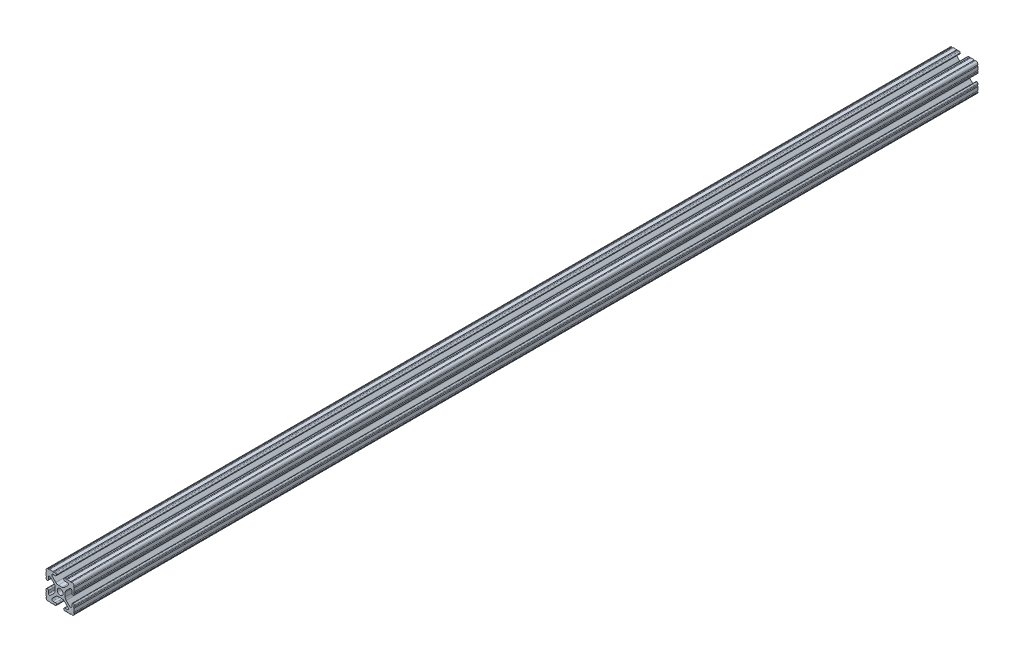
SolidWorks part; units mm, degrees
ref_plane "Front Plane" through (0, 0, 0) normal (0, 0, 1) x (1, 0, 0)
ref_plane "Top Plane" through (0, 0, 0) normal (0, 1, 0) x (1, 0, 0)
ref_plane "Right Plane" through (0, 0, 0) normal (1, 0, 0) x (0, 0, -1)
sketch "Sketch1" plane through (0, 0, 0) normal (0, 0, 1) x (1, 0, 0)
  line L0 (-7.207, 8.7244) -> (-3.8983, 5.4232)
  line L1 (-4.2875, 10.4902) -> (-6.4768, 10.4902)
  line L2 (-3.2385, 11.651) -> (-3.2385, 11.5392)
  line L3 (-5.3171, 12.7) -> (-4.2875, 12.7)
  line L4 (0, 13.4005) -> (0, -14.8534) construction
  line L5 (12.7, 0) -> (-13.9989, 0) construction
  line L6 (-9.5504, 12.7) -> (-6.3331, 12.7)
  line L7 (-12.7, 6.3331) -> (-12.7, 9.5504)
  line L8 (-12.7, 4.2875) -> (-12.7, 5.3171)
  line L9 (-11.5392, 3.2385) -> (-11.651, 3.2385)
  line L10 (-10.4902, 6.4021) -> (-10.4902, 4.2875)
  line L11 (-5.441, 3.8408) -> (-8.7371, 7.1294)
  line L12 (-4.5085, -1.5932) -> (-4.5085, 1.5932)
  line L13 (-1.7093, -4.4958) -> (1.7093, -4.4958)
  line L14 (3.9523, -5.4237) -> (7.1797, -8.6452)
  line L15 (6.4164, -10.4902) -> (4.2875, -10.4902)
  line L16 (3.2385, -11.5392) -> (3.2385, -11.651)
  line L17 (4.2875, -12.7) -> (5.3171, -12.7)
  line L18 (6.3331, -12.7) -> (9.5504, -12.7)
  line L19 (12.7, -9.5504) -> (12.7, -6.3331)
  line L20 (12.7, -5.3171) -> (12.7, -4.2875)
  line L21 (11.651, -3.2385) -> (11.5392, -3.2385)
  line L22 (10.4902, -4.2875) -> (10.4902, -6.4021)
  line L23 (8.7371, -7.1294) -> (5.441, -3.8408)
  line L24 (4.5085, -1.5932) -> (4.5085, 1.5932)
  line L25 (5.441, 3.8408) -> (8.7371, 7.1294)
  line L26 (10.4902, 6.4021) -> (10.4902, 4.2875)
  line L27 (11.5392, 3.2385) -> (11.651, 3.2385)
  line L28 (12.7, 4.2875) -> (12.7, 5.3171)
  line L29 (12.7, 6.3331) -> (12.7, 9.5504)
  line L30 (9.5504, 12.7) -> (6.3331, 12.7)
  line L31 (5.3171, 12.7) -> (4.2875, 12.7)
  line L32 (3.2385, 11.651) -> (3.2385, 11.5392)
  line L33 (4.2875, 10.4902) -> (6.4768, 10.4902)
  line L34 (7.207, 8.7244) -> (3.8983, 5.4232)
  line L35 (1.6558, 4.4958) -> (-1.6558, 4.4958)
  line L36 (-8.7371, -7.1294) -> (-5.441, -3.8408)
  line L37 (-10.4902, -4.2875) -> (-10.4902, -6.4021)
  line L38 (-11.651, -3.2385) -> (-11.5392, -3.2385)
  line L39 (-12.7, -5.3171) -> (-12.7, -4.2875)
  line L40 (-12.7, -9.5504) -> (-12.7, -6.3331)
  line L41 (-6.3331, -12.7) -> (-9.5504, -12.7)
  line L42 (-4.2875, -12.7) -> (-5.3171, -12.7)
  line L43 (-3.2385, -11.5392) -> (-3.2385, -11.651)
  line L44 (-6.4164, -10.4902) -> (-4.2875, -10.4902)
  line L45 (-3.9523, -5.4237) -> (-7.1797, -8.6452)
  arc A0 (-7.207, 8.7244) -> (-6.4768, 10.4902) centre (-6.4768, 9.4563) cw
  arc A1 (-3.2385, 11.5392) -> (-4.2875, 10.4902) centre (-4.2875, 11.5392) cw
  arc A2 (-4.2875, 12.7) -> (-3.2385, 11.651) centre (-4.2875, 11.651) cw
  arc A3 (-5.3171, 12.7) -> (-6.3331, 12.7) centre (-5.8251, 12.7) cw
  arc A4 (-9.5504, 12.7) -> (-10.5664, 12.6998) centre (-10.0584, 12.7) cw
  arc A5 (-12.6998, 10.5664) -> (-10.5664, 12.6998) centre (-10.5918, 10.5918) cw
  arc A6 (-12.6998, 10.5664) -> (-12.7, 9.5504) centre (-12.7, 10.0584) cw
  arc A7 (-12.7, 6.3331) -> (-12.7, 5.3171) centre (-12.7, 5.8251) cw
  arc A8 (-11.651, 3.2385) -> (-12.7, 4.2875) centre (-11.651, 4.2875) cw
  arc A9 (-10.4902, 4.2875) -> (-11.5392, 3.2385) centre (-11.5392, 4.2875) cw
  circle A10 centre (0, 0) radius 2.6035
  arc A11 (-10.4902, 6.4021) -> (-8.7371, 7.1294) centre (-9.4628, 6.4021) cw
  arc A12 (-5.441, 3.8408) -> (-4.5085, 1.5932) centre (-7.6835, 1.5932) cw
  arc A13 (-4.5085, -1.5932) -> (-5.441, -3.8408) centre (-7.6835, -1.5932) cw
  arc A14 (-8.7371, -7.1294) -> (-10.4902, -6.4021) centre (-9.4628, -6.4021) cw
  arc A15 (-1.7093, -4.4958) -> (-3.9523, -5.4237) centre (-1.7093, -7.6708) ccw
  arc A16 (3.9523, -5.4237) -> (1.7093, -4.4958) centre (1.7093, -7.6708) ccw
  arc A17 (6.4164, -10.4902) -> (7.1797, -8.6452) centre (6.4164, -9.4098) ccw
  arc A18 (4.2875, -10.4902) -> (3.2385, -11.5392) centre (4.2875, -11.5392) ccw
  arc A19 (3.2385, -11.651) -> (4.2875, -12.7) centre (4.2875, -11.651) ccw
  arc A20 (6.3331, -12.7) -> (5.3171, -12.7) centre (5.8251, -12.7) ccw
  arc A21 (10.5664, -12.6998) -> (9.5504, -12.7) centre (10.0584, -12.7) ccw
  arc A22 (10.5664, -12.6998) -> (12.6998, -10.5664) centre (10.5918, -10.5918) ccw
  arc A23 (12.7, -9.5504) -> (12.6998, -10.5664) centre (12.7, -10.0584) ccw
  arc A24 (12.7, -5.3171) -> (12.7, -6.3331) centre (12.7, -5.8251) ccw
  arc A25 (12.7, -4.2875) -> (11.651, -3.2385) centre (11.651, -4.2875) ccw
  arc A26 (11.5392, -3.2385) -> (10.4902, -4.2875) centre (11.5392, -4.2875) ccw
  arc A27 (8.7371, -7.1294) -> (10.4902, -6.4021) centre (9.4628, -6.4021) ccw
  arc A28 (4.5085, -1.5932) -> (5.441, -3.8408) centre (7.6835, -1.5932) ccw
  arc A29 (5.441, 3.8408) -> (4.5085, 1.5932) centre (7.6835, 1.5932) ccw
  arc A30 (10.4902, 6.4021) -> (8.7371, 7.1294) centre (9.4628, 6.4021) ccw
  arc A31 (10.4902, 4.2875) -> (11.5392, 3.2385) centre (11.5392, 4.2875) ccw
  arc A32 (11.651, 3.2385) -> (12.7, 4.2875) centre (11.651, 4.2875) ccw
  arc A33 (12.7, 6.3331) -> (12.7, 5.3171) centre (12.7, 5.8251) ccw
  arc A34 (12.6998, 10.5664) -> (12.7, 9.5504) centre (12.7, 10.0584) ccw
  arc A35 (12.6998, 10.5664) -> (10.5664, 12.6998) centre (10.5918, 10.5918) ccw
  arc A36 (9.5504, 12.7) -> (10.5664, 12.6998) centre (10.0584, 12.7) ccw
  arc A37 (5.3171, 12.7) -> (6.3331, 12.7) centre (5.8251, 12.7) ccw
  arc A38 (4.2875, 12.7) -> (3.2385, 11.651) centre (4.2875, 11.651) ccw
  arc A39 (3.2385, 11.5392) -> (4.2875, 10.4902) centre (4.2875, 11.5392) ccw
  arc A40 (7.207, 8.7244) -> (6.4768, 10.4902) centre (6.4768, 9.4563) ccw
  arc A41 (1.6558, 4.4958) -> (3.8983, 5.4232) centre (1.6558, 7.6708) ccw
  arc A42 (-1.6558, 4.4958) -> (-3.8983, 5.4232) centre (-1.6558, 7.6708) cw
  arc A43 (-11.5392, -3.2385) -> (-10.4902, -4.2875) centre (-11.5392, -4.2875) cw
  arc A44 (-12.7, -4.2875) -> (-11.651, -3.2385) centre (-11.651, -4.2875) cw
  arc A45 (-12.7, -5.3171) -> (-12.7, -6.3331) centre (-12.7, -5.8251) cw
  arc A46 (-12.7, -9.5504) -> (-12.6998, -10.5664) centre (-12.7, -10.0584) cw
  arc A47 (-10.5664, -12.6998) -> (-12.6998, -10.5664) centre (-10.5918, -10.5918) cw
  arc A48 (-10.5664, -12.6998) -> (-9.5504, -12.7) centre (-10.0584, -12.7) cw
  arc A49 (-6.3331, -12.7) -> (-5.3171, -12.7) centre (-5.8251, -12.7) cw
  arc A50 (-3.2385, -11.651) -> (-4.2875, -12.7) centre (-4.2875, -11.651) cw
  arc A51 (-4.2875, -10.4902) -> (-3.2385, -11.5392) centre (-4.2875, -11.5392) cw
  arc A52 (-6.4164, -10.4902) -> (-7.1797, -8.6452) centre (-6.4164, -9.4098) cw
  dimension "D1" = 5.207
  dimension "D9" = 14.859
  dimension "D2" = 25.4
  dimension "D3" = 12.7
  dimension "D4" = 6.477
  dimension "D5" = 8.2042
  dimension "D6" = 9.017
  dimension "D8" = 2.2098
  dimension "D10" = 2.2098
extrude "Extrude1" add sketch "Sketch1" against normal blind 812.8
